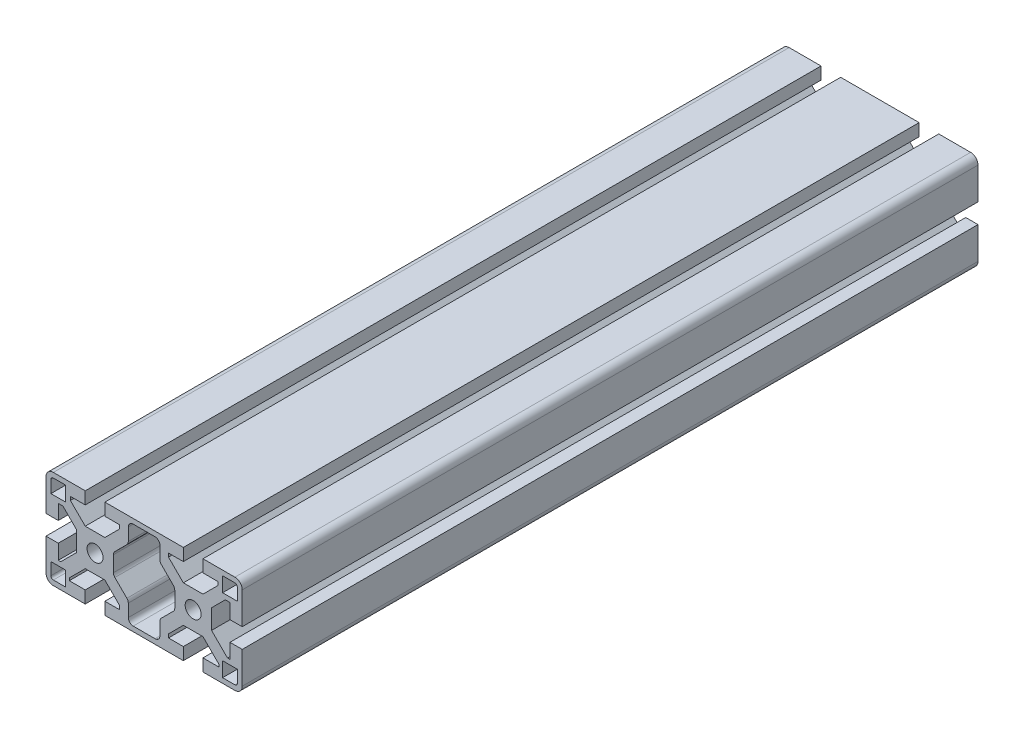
SolidWorks part; units mm, degrees
ref_plane "Alzado" through (0, 0, 0) normal (0, 0, 1) x (1, 0, 0)
ref_plane "Planta" through (0, 0, 0) normal (0, 1, 0) x (1, 0, 0)
ref_plane "Vista lateral" through (0, 0, 0) normal (1, 0, 0) x (0, 0, -1)
sketch "Croquis1" plane through (0, 0, 0) normal (0, 0, 1) x (1, 0, 0)
  line L0 (-18, 12) -> (-12, 12)
  line L1 (-12, 12) -> (-12, 18)
  line L2 (-17, 18) -> (-12, 18)
  line L3 (-18, 12) -> (-18, 17)
  line L4 (24.45, 18) -> (15.55, 18)
  line L5 (31.9142, 4.5858) -> (27.0358, 9.4642)
  line L6 (31.9142, -4.5858) -> (27.0358, -9.4642)
  line L7 (50.0629, 13.55) -> (50.0629, 15)
  line L8 (-17, -18) -> (-12, -18)
  line L9 (-12, -18) -> (-12, -12)
  line L10 (-18, -12) -> (-12, -12)
  line L11 (-18, -17) -> (-18, -12)
  line L12 (50.0629, 13.55) -> (44, 7.5)
  line L13 (50.0629, 15) -> (44, 15)
  line L14 (29.95, 13.55) -> (29.95, 15)
  line L15 (36, 7.5) -> (29.95, 13.55)
  line L16 (-4, 7.5) -> (4, 7.5)
  line L17 (-17, 20) -> (-4, 20)
  line L18 (-7.5, -3.55) -> (-7.5, 4.45)
  line L19 (-4, -7.5) -> (4, -7.5)
  line L20 (7.5, -3.1716) -> (7.5, 3.1716)
  line L21 (36, 15) -> (29.95, 15)
  line L22 (4, 20) -> (4, 15)
  line L23 (55, 10.05) -> (53.1, 10.05)
  line L24 (4, 20) -> (36, 20)
  line L25 (-17, -20) -> (-4, -20)
  line L26 (-4, -20) -> (-4, -15)
  line L27 (36, -20) -> (4, -20)
  line L28 (-15, -10.05) -> (-15, -4)
  line L29 (-20, 4) -> (-20, 17)
  line L30 (-20, -17) -> (-20, -4)
  line L31 (-20, -4) -> (-15, -4)
  line L32 (4, -20) -> (4, -15)
  line L33 (-4, 20) -> (-4, 15)
  line L34 (47.5, 4.45) -> (53.1, 10.05)
  line L35 (55, 4) -> (55, 10.05)
  line L36 (60, 4) -> (55, 4)
  line L37 (4, -15) -> (10.05, -15)
  line L38 (-10.5, -15) -> (-4, -15)
  line L39 (-10.5, -14) -> (-4, -7.5)
  line L40 (-10.5, -14) -> (-10.5, -15)
  line L41 (4, -7.5) -> (10.05, -13.55)
  line L42 (10.05, -15) -> (10.05, -13.55)
  line L43 (-7.5, -3.55) -> (-14, -10.05)
  line L44 (-15, -10.05) -> (-14, -10.05)
  line L45 (-20, 4) -> (-15, 4)
  line L46 (-15, 4) -> (-15, 10.05)
  line L47 (-7.5, 4.45) -> (-13.1, 10.05)
  line L48 (-15, 10.05) -> (-13.1, 10.05)
  line L49 (4, 15) -> (10.05, 15)
  line L50 (4, 7.5) -> (10.05, 13.55)
  line L51 (10.05, 13.55) -> (10.05, 15)
  line L52 (-10.0629, 15) -> (-4, 15)
  line L53 (-10.0629, 13.55) -> (-4, 7.5)
  line L54 (-10.0629, 13.55) -> (-10.0629, 15)
  line L55 (55, -10.05) -> (54, -10.05)
  line L56 (47.5, -3.55) -> (54, -10.05)
  line L57 (8.0858, -4.5858) -> (12.9642, -9.4642)
  line L58 (29.95, -15) -> (29.95, -13.55)
  line L59 (8.0858, 4.5858) -> (12.9642, 9.4642)
  line L60 (36, -7.5) -> (29.95, -13.55)
  line L61 (50.5, -14) -> (50.5, -15)
  line L62 (50.5, -14) -> (44, -7.5)
  line L63 (50.5, -15) -> (44, -15)
  line L64 (36, -15) -> (29.95, -15)
  line L65 (44, 20) -> (44, 15)
  line L66 (36, -20) -> (36, -15)
  line L67 (60, -4) -> (55, -4)
  line L68 (60, -17) -> (60, -4)
  line L69 (60, 4) -> (60, 17)
  line L70 (55, -10.05) -> (55, -4)
  line L71 (44, -20) -> (44, -15)
  line L72 (57, -20) -> (44, -20)
  line L73 (36, 20) -> (36, 15)
  line L74 (32.5, -3.1716) -> (32.5, 3.1716)
  line L75 (44, -7.5) -> (36, -7.5)
  line L76 (47.5, -3.55) -> (47.5, 4.45)
  line L77 (57, 20) -> (44, 20)
  line L78 (44, 7.5) -> (36, 7.5)
  line L79 (58, -17) -> (58, -12)
  line L80 (58, -12) -> (52, -12)
  line L81 (52, -18) -> (52, -12)
  line L82 (57, -18) -> (52, -18)
  line L83 (58, 12) -> (58, 17)
  line L84 (57, 18) -> (52, 18)
  line L85 (52, 12) -> (52, 18)
  line L86 (58, 12) -> (52, 12)
  line L87 (13.55, 10.8784) -> (13.55, 16)
  line L88 (26.45, 10.8784) -> (26.45, 16)
  line L89 (24.45, -18) -> (15.55, -18)
  line L90 (13.55, -10.8784) -> (13.55, -16)
  line L91 (26.45, -10.8784) -> (26.45, -16)
  arc A0 (-18, 17) -> (-17, 18) centre (-17, 17) cw
  arc A1 (57, -20) -> (60, -17) centre (57, -17) ccw
  arc A2 (-18, -17) -> (-17, -18) centre (-17, -17) ccw
  arc A3 (60, 17) -> (57, 20) centre (57, 17) ccw
  circle A4 centre (0, 0) radius 3.25
  circle A5 centre (40, 0) radius 3.25
  arc A6 (-20, 17) -> (-17, 20) centre (-17, 17) cw
  arc A7 (-17, -20) -> (-20, -17) centre (-17, -17) cw
  arc A8 (58, -17) -> (57, -18) centre (57, -17) cw
  arc A9 (58, 17) -> (57, 18) centre (57, 17) ccw
  arc A10 (13.55, 16) -> (15.55, 18) centre (15.55, 16) cw
  arc A11 (12.9642, 9.4642) -> (13.55, 10.8784) centre (11.55, 10.8784) ccw
  arc A12 (7.5, 3.1716) -> (8.0858, 4.5858) centre (9.5, 3.1716) cw
  arc A13 (8.0858, -4.5858) -> (7.5, -3.1716) centre (9.5, -3.1716) cw
  arc A14 (13.55, -10.8784) -> (12.9642, -9.4642) centre (11.55, -10.8784) ccw
  arc A15 (15.55, -18) -> (13.55, -16) centre (15.55, -16) cw
  arc A16 (26.45, -16) -> (24.45, -18) centre (24.45, -16) cw
  arc A17 (32.5, -3.1716) -> (31.9142, -4.5858) centre (30.5, -3.1716) cw
  arc A18 (26.45, -10.8784) -> (27.0358, -9.4642) centre (28.45, -10.8784) cw
  arc A19 (26.45, 16) -> (24.45, 18) centre (24.45, 16) ccw
  arc A20 (26.45, 10.8784) -> (27.0358, 9.4642) centre (28.45, 10.8784) ccw
  arc A21 (32.5, 3.1716) -> (31.9142, 4.5858) centre (30.5, 3.1716) ccw
  point P115 (13.55, 10.05)
  point P118 (7.5, 4)
  point P121 (7.5, -4)
  point P124 (13.55, -10.05)
extrude "Extruir5" add sketch "Croquis1" along normal blind 300
